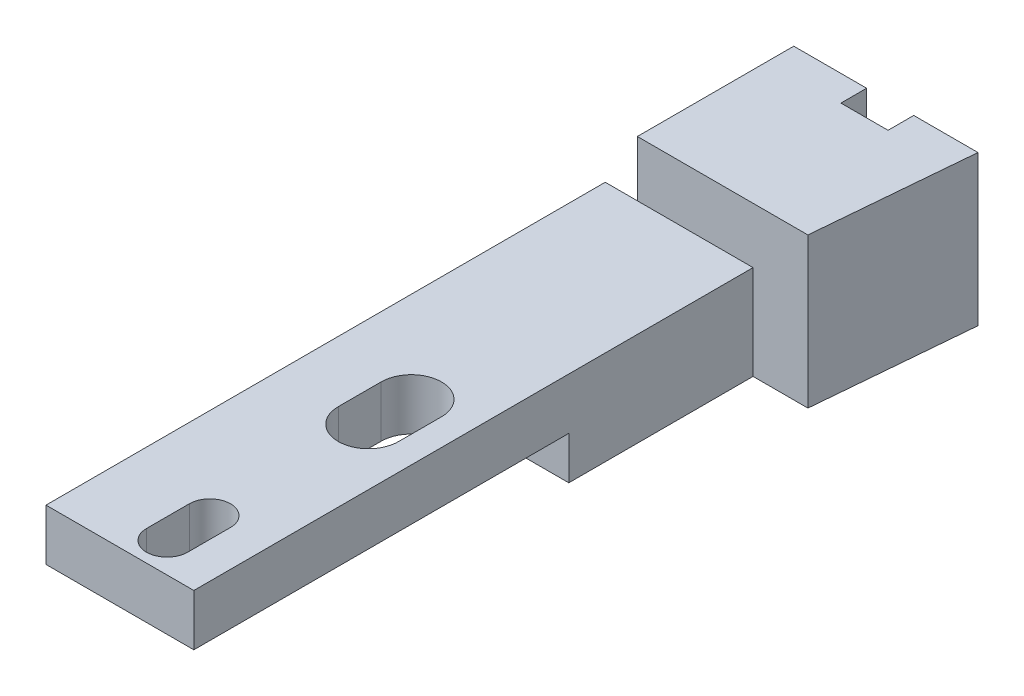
SolidWorks part; units mm, degrees
ref_plane "Front" through (0, 0, 0) normal (0, 0, 1) x (1, 0, 0)
ref_plane "Top" through (0, 0, 0) normal (0, 1, 0) x (1, 0, 0)
ref_plane "Right" through (0, 0, 0) normal (1, 0, 0) x (0, 0, -1)
sketch "Sketch1" plane through (0, 0, 0) normal (0, 0, 1) x (1, 0, 0)
  line L1 (-6.096, 12.7) -> (5.334, 12.7)
  line L2 (-6.096, 12.7) -> (-6.096, 21.59)
  line L3 (-6.096, 21.59) -> (5.334, 21.59)
  line L4 (5.334, 12.7) -> (5.334, 21.59)
  dimension "D1" = 8.89
  dimension "D2" = 12.7
  dimension "D3" = 5.334
  dimension "D4" = 11.43
extrude "Extrude1" add sketch "Sketch1" along normal blind 33.02
sketch "Sketch3" plane through (0, 21.59, 0) normal (0, 1, 0) x (-1, 0, 0)
  line L1 (-5.334, 33.02) -> (-2.794, 33.02)
  line L2 (-5.334, 33.02) -> (-5.334, 9.271)
  line L3 (-5.334, 9.271) -> (-2.794, 9.271)
  line L4 (-2.794, 33.02) -> (-2.794, 9.271)
  dimension "D1" = 23.749
  dimension "D2" = 2.54
extrude "Cut-Extrude1" cut sketch "Sketch3" against normal through all
sketch "Sketch4" plane through (0, 21.59, 0) normal (0, 1, 0) x (-1, 0, 0)
  line L1 (-2.794, 9.271) -> (6.096, 9.271)
  line L2 (-2.794, 9.271) -> (-2.794, 33.02)
  line L3 (-2.794, 33.02) -> (6.096, 33.02)
  line L4 (6.096, 9.271) -> (6.096, 33.02)
extrude "Cut-Extrude2" cut sketch "Sketch4" against normal blind 2.54
sketch "Sketch5" plane through (0, 19.05, 0) normal (0, 1, 0) x (-1, 0, 0)
  line L0 (6.096, 33.02) -> (-2.794, 33.02) construction
  line L1 (-2.794, 9.271) -> (-0.889, 9.271)
  line L2 (-2.794, 9.271) -> (-2.794, 33.02)
  line L3 (-2.794, 33.02) -> (-0.889, 33.02)
  line L4 (-0.889, 9.271) -> (-0.889, 33.02)
  dimension "D1" = 1.905
extrude "Cut-Extrude3" cut sketch "Sketch5" against normal through all
sketch "Sketch7" plane through (0, 0, 0) normal (0, 1, 0) x (1, 0, 0)
  line L0 (5.334, 0) -> (4.5229, -9.271)
  line L1 (5.334, -9.271) -> (-6.096, -9.271) construction
  line L2 (4.5229, -9.271) -> (5.334, -9.271)
  line L3 (5.334, -9.271) -> (5.334, 0)
  dimension "D1" = 5
extrude "Cut-Extrude5" cut sketch "Sketch7" along normal through all
hole_wizard "1/16 (0.062500) Diameter Hole1" positions "Sketch9" profile "Sketch8" hole size "1/16" standard "Ansi Inch"
sketch "Sketch9" plane through (0, 0, 0) normal (0, 0, -1) x (-1, 0, 0)
  line L0 (-5.334, 12.7) -> (-5.334, 21.59) construction
  line L1 (6.096, 12.7) -> (-5.334, 12.7) construction
  point P0 (-2.794, 19.05)
  point P1 (3.556, 15.24)
  dimension "D1" = 2.54
  dimension "D2" = 6.35
  dimension "D3" = 8.89
  dimension "D4" = 2.54
sketch "Sketch8" plane through (2.794, 19.05, 0) normal (1, 0, 0) x (0, 1, 0)
  line L0 (0, 0) -> (0, 4.7949)
  line L1 (0, 4.7949) -> (0.7937, 4.318)
  line L2 (0.7937, 4.318) -> (0.7937, 0)
  line L5 (0.7937, 0) -> (0, 0)
  line L10 (0, 4.7949) -> (-0.7938, 4.318) construction
  line L11 (0, -6.35) -> (0, 107.95) construction
  dimension "Hole Dia." = 1.5875
  dimension "Hole Depth" = 4.318
  dimension "Drill Angle" = 118
hole_wizard "#2-56 Tapped Hole1" positions "Sketch11" profile "Sketch10" tap size "#2-56" standard "Ansi Inch"
sketch "Sketch11" plane through (0, 0, 0) normal (0, 0, -1) x (-1, 0, 0)
  line L0 (6.096, 12.7) -> (-5.334, 12.7) construction
  line L1 (-5.334, 12.7) -> (-5.334, 21.59) construction
  point P0 (-2.794, 15.24)
  point P1 (3.556, 19.05)
  dimension "D1" = 2.54
  dimension "D2" = 6.35
  dimension "D3" = 2.54
  dimension "D4" = 8.89
sketch "Sketch10" plane through (2.794, 15.24, 0) normal (1, 0, 0) x (0, 1, 0)
  line L0 (0, 0) -> (0, 5.7328)
  line L1 (0, 5.7328) -> (0.889, 5.7328)
  line L2 (0.889, 5.7328) -> (0.889, 0)
  line L5 (0.889, 0) -> (0, 0)
  line L10 (0, 5.7328) -> (-0.889, 5.7328) construction
  line L11 (0, -6.35) -> (0, 107.95) construction
  dimension "Tap Drill Dia." = 1.778
  dimension "Tap Drill Depth" = 5.7328
  dimension "Drill Angle" = 180
sketch "Sketch12" plane through (0, 0, 0) normal (0, 0, -1) x (-1, 0, 0)
  line L0 (-5.334, 21.59) -> (6.096, 21.59) construction
  line L1 (-1.016, 21.59) -> (1.778, 21.59)
  line L2 (-1.016, 21.59) -> (-1.016, 12.7)
  line L3 (-1.016, 12.7) -> (1.778, 12.7)
  line L4 (1.778, 21.59) -> (1.778, 12.7)
  line L5 (6.096, 12.7) -> (-5.334, 12.7) construction
  line L6 (-2.794, 15.24) -> (3.556, 15.24) construction
  line L7 (-1.016, 15.24) -> (1.778, 15.24) construction
  circle A0 centre (3.556, 15.24) radius 0.7937 construction
  circle A1 centre (-2.794, 15.24) radius 0.889 construction
  point P17 (0.381, 15.24)
  dimension "D1" = 2.794
extrude "Cut-Extrude6" cut sketch "Sketch12" against normal blind 1.524
sketch "Sketch15" plane through (-6.096, 0, 0) normal (-1, 0, 0) x (0, 0, 1)
  line L0 (33.02, 12.7) -> (0, 12.7) construction
  line L1 (33.02, 19.05) -> (9.271, 19.05)
  line L2 (33.02, 19.05) -> (33.02, 12.7)
  line L3 (33.02, 12.7) -> (9.271, 12.7)
  line L4 (9.271, 19.05) -> (9.271, 12.7)
  line L5 (9.271, 19.05) -> (9.271, 21.59) construction
extrude "Extrude5" add sketch "Sketch15" along normal blind 3.175
sketch "Sketch6" plane through (0, 19.05, 0) normal (0, 1, 0) x (-1, 0, 0)
  line L0 (9.271, 9.271) -> (6.096, 9.271) construction
  circle A2 centre (2.6035, 27.432) radius 1.7907
  dimension "D1" = 18.161
  dimension "D3" = 3.5814
  dimension "D2" = 2.6035
extrude "Cut-Extrude4" cut sketch "Sketch6" against normal through all
sketch "Sketch16" plane through (0, 0, 33.02) normal (0, 0, 1) x (1, 0, 0)
  line L1 (0.889, 19.05) -> (-9.271, 19.05)
  line L2 (0.889, 19.05) -> (0.889, 12.7)
  line L3 (0.889, 12.7) -> (-9.271, 12.7)
  line L4 (-9.271, 19.05) -> (-9.271, 12.7)
extrude "Extrude6" add sketch "Sketch16" along normal blind 9.398
hole_wizard "#41 (0.096) Diameter Hole1" positions "Sketch18" profile "Sketch17" hole size "#41" standard "Ansi Inch"
sketch "Sketch18" plane through (0, 19.05, 0) normal (0, 1, 0) x (-1, 0, 0)
  line L0 (-0.889, 39.37) -> (9.271, 39.37) construction
  line L1 (-0.889, 9.271) -> (-0.889, 42.418) construction
  line L2 (9.271, 42.418) -> (9.271, 9.271) construction
  line L3 (-0.889, 42.418) -> (9.271, 42.418) construction
  point P0 (2.6035, 39.37)
  dimension "D1" = 3.048
  dimension "D2" = 2.6035
sketch "Sketch17" plane through (-2.6035, 19.05, 39.37) normal (1, 0, 0) x (0, 0, 1)
  line L0 (0, 0) -> (0, 6.35)
  line L1 (0, 6.35) -> (1.2192, 6.35)
  line L2 (1.2192, 6.35) -> (1.2192, 0)
  line L5 (1.2192, 0) -> (0, 0)
  line L11 (0, -6.35) -> (0, 107.95) construction
  dimension "Thru Hole Dia." = 2.4384
  dimension "Thru Hole Depth" = 6.35
sketch "Sketch19" plane through (0, 19.05, 0) normal (0, 1, 0) x (-1, 0, 0)
  line L1 (-0.889, 9.271) -> (9.271, 9.271)
  line L2 (-0.889, 9.271) -> (-0.889, 42.418)
  line L3 (-0.889, 42.418) -> (9.271, 42.418)
  line L4 (9.271, 9.271) -> (9.271, 42.418)
extrude "Cut-Extrude7" cut sketch "Sketch19" against normal blind 0.762
sketch "Sketch20" plane through (0, 12.7, 0) normal (0, -1, 0) x (1, 0, 0)
  line L0 (4.5229, 9.271) -> (5.334, 0)
  line L1 (5.334, 0) -> (4.8241, 0)
  line L2 (4.5229, 9.271) -> (4.013, 9.271)
  line L3 (4.013, 9.271) -> (4.8241, 0)
  line L4 (4.5229, 9.271) -> (5.334, 0) construction
  line L5 (4.5229, 9.271) -> (0.889, 9.271) construction
  line L6 (1.016, 0) -> (5.334, 0) construction
  dimension "D1" = 0.508
extrude "Cut-Extrude8" cut sketch "Sketch20" against normal through all
sketch "Sketch21" plane through (-6.096, 0, 0) normal (-1, 0, 0) x (0, 0, 1)
  line L0 (0, 12.7) -> (3.81, 12.7)
  line L1 (9.271, 12.7) -> (0, 12.7) construction
  line L2 (0, 12.7) -> (0, 16.51)
  line L3 (0, 21.59) -> (0, 12.7) construction
  line L4 (0, 16.51) -> (3.81, 12.7)
  dimension "D1" = 3.81
extrude "Cut-Extrude9" cut sketch "Sketch21" against normal blind 1.143
sketch "Sketch22" plane through (0.889, 0, 0) normal (-1, 0, 0) x (0, 0, 1)
  line L1 (9.271, 18.288) -> (42.418, 18.288)
  line L2 (9.271, 18.288) -> (9.271, 12.7)
  line L3 (9.271, 12.7) -> (42.418, 12.7)
  line L4 (42.418, 18.288) -> (42.418, 12.7)
extrude "Cut-Extrude10" cut sketch "Sketch22" along normal blind 0.127
sketch "Sketch23" plane through (-9.271, 0, 0) normal (-1, 0, 0) x (0, 0, 1)
  line L1 (9.271, 18.288) -> (42.418, 18.288)
  line L2 (9.271, 18.288) -> (9.271, 12.7)
  line L3 (9.271, 12.7) -> (42.418, 12.7)
  line L4 (42.418, 18.288) -> (42.418, 12.7)
extrude "Cut-Extrude11" cut sketch "Sketch23" against normal blind 1.27
sketch "Sketch24" plane through (0.762, 0, 0) normal (1, 0, 0) x (0, 0, -1)
  line L1 (-42.418, 12.7) -> (-20.193, 12.7)
  line L2 (-42.418, 12.7) -> (-42.418, 15.24)
  line L3 (-42.418, 15.24) -> (-20.193, 15.24)
  line L4 (-20.193, 12.7) -> (-20.193, 15.24)
  dimension "D1" = 2.54
  dimension "D2" = 22.225
extrude "Cut-Extrude12" cut sketch "Sketch24" against normal through all
sketch "Sketch25" plane through (0, 18.288, 0) normal (0, 1, 0) x (1, 0, 0)
  line L0 (-0.8128, -26.162) -> (-0.8128, -28.702)
  line L1 (-4.3942, -28.702) -> (-4.3942, -26.162)
  line L3 (-1.3843, -38.1) -> (-1.3843, -40.64)
  line L4 (-3.8227, -40.64) -> (-3.8227, -38.1)
  line L6 (-0.8128, -27.432) -> (-4.3942, -27.432) construction
  line L8 (-1.3843, -39.37) -> (-3.8227, -39.37) construction
  circle A0 centre (-2.6035, -27.432) radius 1.7907 construction
  arc A1 (-4.3942, -28.702) -> (-0.8128, -28.702) centre (-2.6035, -28.702) ccw
  arc A2 (-4.3942, -26.162) -> (-0.8128, -26.162) centre (-2.6035, -26.162) cw
  circle A3 centre (-2.6035, -39.37) radius 1.2192 construction
  arc A4 (-3.8227, -40.64) -> (-1.3843, -40.64) centre (-2.6035, -40.64) ccw
  arc A5 (-3.8227, -38.1) -> (-1.3843, -38.1) centre (-2.6035, -38.1) cw
  dimension "D1" = 1.27
  dimension "D2" = 1.27
extrude "Cut-Extrude13" cut sketch "Sketch25" against normal through all
